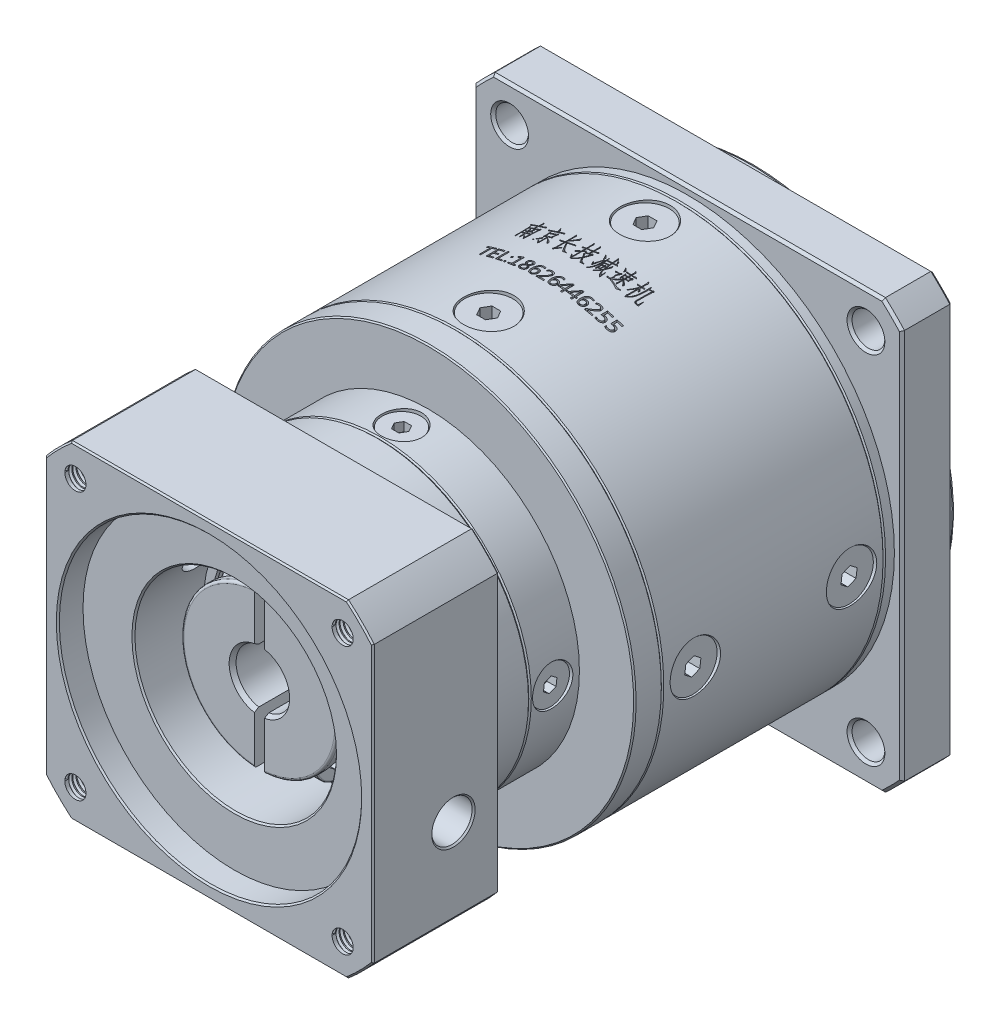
SolidWorks part; units mm, degrees
ref_plane "前视基准面" through (0, 0, 0) normal (0, 0, 1) x (1, 0, 0)
ref_plane "上视基准面" through (0, 0, 0) normal (0, 1, 0) x (1, 0, 0)
ref_plane "右视基准面" through (0, 0, 0) normal (1, 0, 0) x (0, 0, -1)
imported_body "11-60-75-M5-1-solid1"
imported_body "11-60-75-M5-1-solid2"
imported_body "11-60-75-M5-1-solid3"
imported_body "11-60-75-M5-1-solid4"
imported_body "11-60-75-M5-1-solid5"
imported_body "ZF80-K15-L2-F60-8-solid1"
imported_body "ZF80-K15-L2-F60-8-solid2"
imported_body "ZF80-K15-L2-F60-8-solid3"
imported_body "ZF80-K15-L2-F60-8-solid4"
imported_body "ZF80-K15-L2-F60-8-solid5"
imported_body "ZF80-K15-L2-F60-8-solid6"
imported_body "ZF80-K15-L2-F60-8-solid7"
imported_body "ZF80-K15-L2-F60-8-solid8"
imported_body "ZF80-K15-L2-F60-8-solid9"
imported_body "ZF80-K15-L2-F60-8-solid10"
imported_body "ZF80-K15-L2-F60-8-solid11"
imported_body "ZF80-K15-L2-F60-8-solid12"
imported_body "ZF80-K15-L2-F60-8-solid13"
sketch "草图1" plane through (0, 0, -47.2941) normal (0, 0, -1) x (-1, 0, 0)
  circle A0 centre (69.3824, 21.5463) radius 11.0458
  dimension "D1" = 22.0916
extrude "凸台-拉伸1" add sketch "草图1" along normal blind 5
